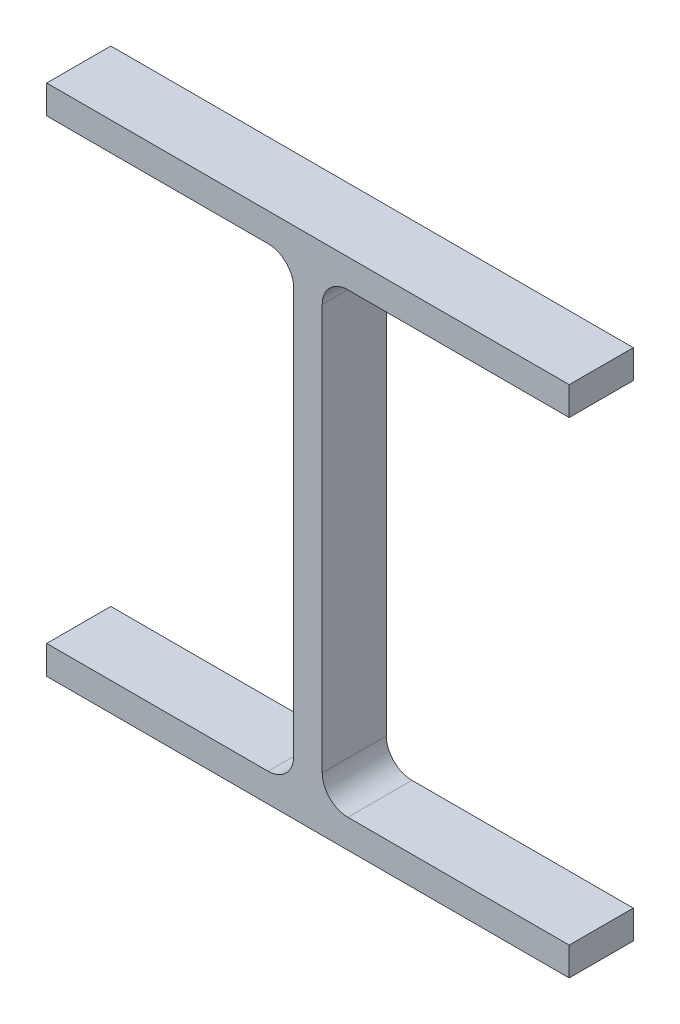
SolidWorks part; units mm, degrees
ref_plane "Plane1" through (0, 0, 0) normal (0, 0, 1) x (1, 0, 0)
ref_plane "Plane2" through (0, 0, 0) normal (0, 1, 0) x (1, 0, 0)
ref_plane "Plane3" through (0, 0, 0) normal (1, 0, 0) x (0, 0, -1)
sketch "Sketch1" plane through (0, 0, 0) normal (0, 0, 1) x (1, 0, 0)
  line L0 (0, 0) -> (0, 11.303)
  line L1 (0, 11.303) -> (87.757, 11.303)
  line L2 (97.917, 21.463) -> (97.917, 182.245)
  line L3 (87.757, 192.405) -> (0, 192.405)
  line L4 (0, 192.405) -> (0, 203.708)
  line L5 (0, 203.708) -> (207.137, 203.708)
  line L6 (207.137, 203.708) -> (207.137, 192.405)
  line L7 (207.137, 192.405) -> (119.38, 192.405)
  line L8 (109.22, 182.245) -> (109.22, 21.463)
  line L9 (119.38, 11.303) -> (207.137, 11.303)
  line L10 (207.137, 11.303) -> (207.137, 0)
  line L11 (207.137, 0) -> (0, 0)
  line L12 (103.5685, -72.1361) -> (103.5685, 203.708) construction
  arc A0 (87.757, 11.303) -> (97.917, 21.463) centre (87.757, 21.463) ccw
  arc A1 (97.917, 182.245) -> (87.757, 192.405) centre (87.757, 182.245) ccw
  arc A2 (119.38, 192.405) -> (109.22, 182.245) centre (119.38, 182.245) ccw
  arc A3 (109.22, 21.463) -> (119.38, 11.303) centre (119.38, 21.463) ccw
extrude "BaseSteelHP" add sketch "Sketch1" against normal mid plane 25.4
equation "\"D1@Sketch1\" = \"Tw@Sketch1\" / 2"
equation "\"D2@Sketch1\" = \"Tf@Sketch1\""
